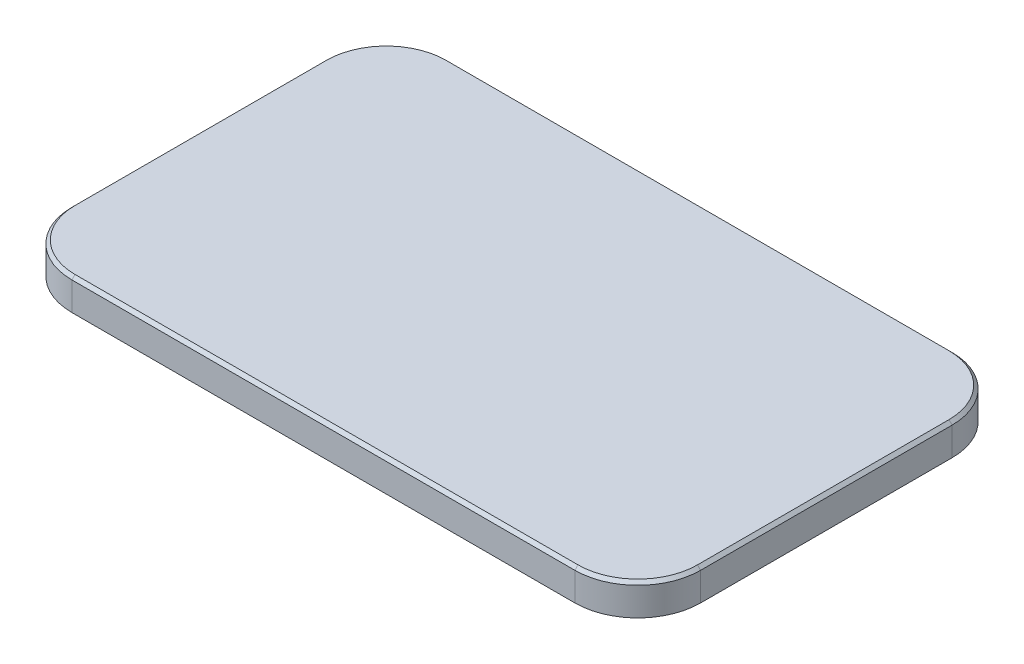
SolidWorks part; units mm, degrees
ref_plane "Plane1" through (0, 0, 0) normal (0, 0, 1) x (1, 0, 0)
ref_plane "Plane2" through (0, 0, 0) normal (0, 1, 0) x (1, 0, 0)
ref_plane "Plane3" through (0, 0, 0) normal (1, 0, 0) x (0, 0, -1)
sketch "Sketch1" plane through (0, 0, 0) normal (0, 1, 0) x (1, 0, 0)
  line L0 (-63.5, 38.1) -> (63.5, -38.1) construction
  line L1 (-63.5, 38.1) -> (63.5, 38.1)
  line L2 (-63.5, 38.1) -> (-63.5, -38.1)
  line L3 (-63.5, -38.1) -> (63.5, -38.1)
  line L4 (63.5, 38.1) -> (63.5, -38.1)
  dimension "D1" = 127
  dimension "D2" = 76.2
extrude "Extrude1" add sketch "Sketch1" along normal blind 6.35
fillet "Fillet1" radius 12.7 4 edges at (-63.5, 3.175, -38.1) (63.5, 3.175, -38.1) (63.5, 3.175, 38.1) (-63.5, 3.175, 38.1)
chamfer "Chamfer1" distance 0.635 angle 45 8 edges at (0, 6.35, -38.1) (63.5, 6.35, 0) (0, 6.35, 38.1) (-63.5, 6.35, 0) (59.7803, 6.35, -34.3803) (59.7803, 6.35, 34.3803) (-59.7803, 6.35, 34.3803) (-59.7803, 6.35, -34.3803)
